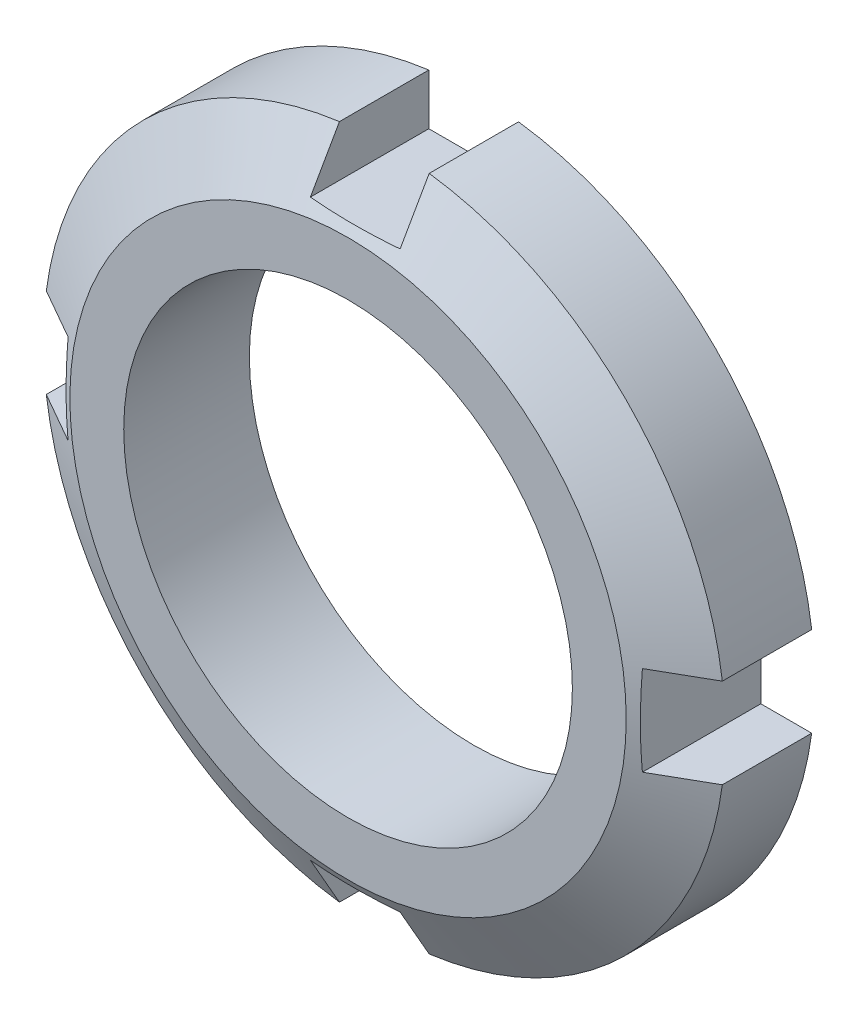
SolidWorks part; units mm, degrees
ref_plane "Plan1" through (0, 0, 0) normal (0, 0, 1) x (1, 0, 0)
ref_plane "Plan2" through (0, 0, 0) normal (0, 1, 0) x (1, 0, 0)
ref_plane "Plan3" through (0, 0, 0) normal (1, 0, 0) x (0, 0, -1)
sketch "Esquisse1" plane through (0, 0, 0) normal (0, 0, 1) x (1, 0, 0)
  circle A0 centre (0, 0) radius 19
  dimension "D1" = 38
extrude "Base-Extrusion" add sketch "Esquisse1" along normal blind 7
sketch "Esquisse2" plane through (0, 0, 7) normal (0, 0, 1) x (1, 0, 0)
  circle A0 centre (0, 0) radius 12.5
  dimension "D1" = 25
extrude "Enlèv. mat.-Extru.1" cut sketch "Esquisse2" against normal through all
chamfer "Chanfrein1" distance 3.5 angle 30
sketch "Esquisse3" plane through (0, 0, 7) normal (0, 0, 1) x (1, 0, 0)
  line L0 (-2.5, 19) -> (2.5, 19)
  line L1 (-2.5, 19) -> (-2.5, 16)
  line L2 (2.5, 16) -> (-2.5, 16)
  line L3 (2.5, 16) -> (2.5, 19)
  line L4 (0, 0) -> (30, 0) construction
  line L5 (0, 0) -> (0, 40) construction
  dimension "D1" = 5
  dimension "D2" = 3
  dimension "D3" = 16
  dimension "D4" = 90
extrude "Enlèv. mat.-Extru.2" cut sketch "Esquisse3" against normal through all
sketch "Esquisse4" plane through (0, 0, 7) normal (0, 0, 1) x (1, 0, 0)
  point P0 (0, 0)
pattern_circular "Répétition circulaire1" count 4 every 90
